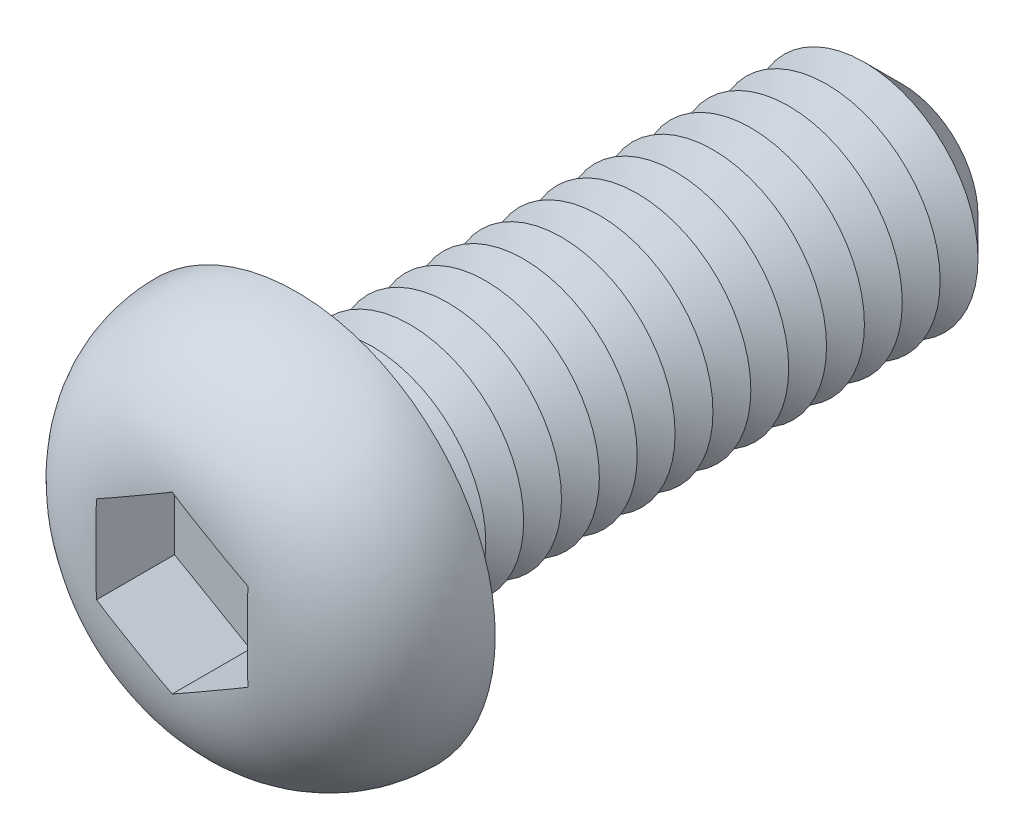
SolidWorks part; units mm, degrees
ref_plane "Front Plane" through (0, 0, 0) normal (0, 0, 1) x (1, 0, 0)
ref_plane "Top Plane" through (0, 0, 0) normal (0, 1, 0) x (1, 0, 0)
ref_plane "Right Plane" through (0, 0, 0) normal (1, 0, 0) x (0, 0, -1)
sketch "Sketch1" plane through (0, 0, 0) normal (1, 0, 0) x (0, 0, -1)
  line L0 (-47.9342, 0) -> (60.3146, 0) construction
sketch "Sketch2" plane through (0, 0, 0) normal (1, 0, 0) x (0, 0, -1)
  line L0 (0, 0) -> (-3.3, 0)
  line L1 (-47.9342, 0) -> (60.3146, 0) construction
  line L2 (-3.3, 0) -> (-3.3, 1.95)
  line L3 (0, 5.25) -> (0, 0)
  arc A0 (-3.3, 1.95) -> (0, 5.25) centre (0, 1.95) cw
  dimension "D1" = 3.3
  dimension "D2" = 3.3
  dimension "D3" = 5.25
revolve "Revolve1" add sketch "Sketch2" angle 360 about L0
sketch "Sketch3" plane through (0, 0, 3.3) normal (0, 0, 1) x (1, 0, 0)
  line L1 (0, 2.3094) -> (-2, 1.1547)
  line L2 (-2, 1.1547) -> (-2, -1.1547)
  line L3 (-2, -1.1547) -> (0, -2.3094)
  line L4 (0, -2.3094) -> (2, -1.1547)
  line L5 (2, -1.1547) -> (2, 1.1547)
  line L6 (2, 1.1547) -> (0, 2.3094)
  circle A0 centre (0, 0) radius 2 construction
  dimension "D1" = 4
extrude "Cut-Extrude1" cut sketch "Sketch3" against normal blind 2.08
sketch "Sketch4" plane through (0, 0, 0) normal (0, 0, -1) x (-1, 0, 0)
  circle A0 centre (0, 0) radius 3
  dimension "D1" = 6
extrude "Boss-Extrude1" add sketch "Sketch4" along normal blind 16
chamfer "Chamfer1" distance 1 angle 45 1 edges at (-3, 0, -16)
sketch "Sketch5" plane through (0, 0, 0) normal (1, 0, 0) x (0, 0, -1)
  line L0 (1, 3) -> (2, 3)
  line L1 (15, 3) -> (0, 3) construction
  line L2 (2, 3) -> (1.5, 2.134)
  line L3 (1.5, 2.134) -> (1, 3)
  line L4 (0, -5.25) -> (0, 5.25) construction
  line L5 (15, 3) -> (0, 3) construction
  dimension "D1" = 1
  dimension "D2" = 1
revolve "Cut-Revolve1" cut sketch "Sketch5" angle 360 about L0
pattern_linear "LPattern1" count 14 spacing 1 along (0, 0, -1) of "Cut-Revolve1"
fillet "Fillet2" radius 0.5 1 edges at (3, 0, 0)
sketch "Sketch6" plane through (0, 0, 1.22) normal (0, 0, 1) x (1, 0, 0)
  circle A0 centre (0, 0) radius 0.8
  dimension "D1" = 1.6
extrude "Cut-Extrude2" cut sketch "Sketch6" against normal up to surface (17.22 mm away)
